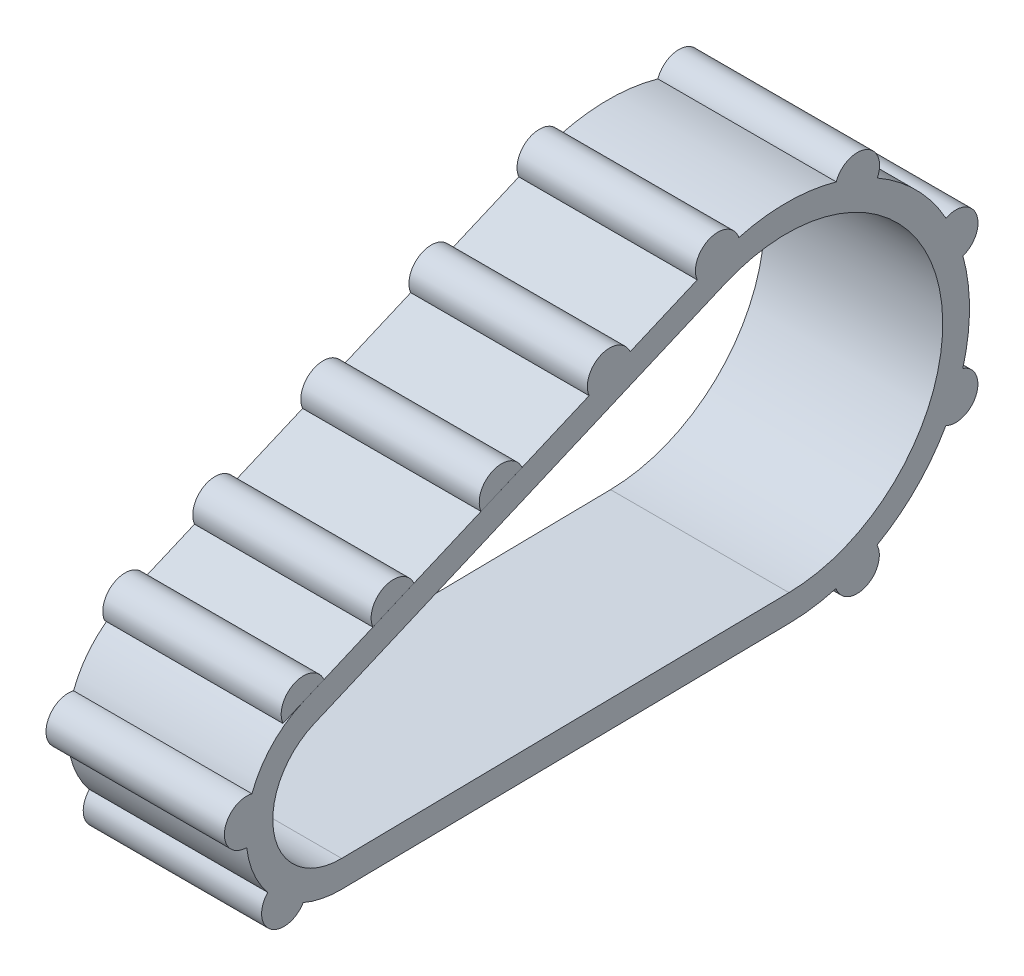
SolidWorks part; units mm, degrees
ref_plane "Front Plane" through (0, 0, 0) normal (0, 0, 1) x (1, 0, 0)
ref_plane "Top Plane" through (0, 0, 0) normal (0, 1, 0) x (1, 0, 0)
ref_plane "Right Plane" through (0, 0, 0) normal (1, 0, 0) x (0, 0, -1)
mirrored part "tread with tread 5 belt2.dennis_Mirrored"
other "<tread with tread 5 belt2.dennis>-<Boss-Extrude4[1]>"
other "<tread with tread 5 belt2.dennis>-<Boss-Extrude4[2]>"
other "<tread with tread 5 belt2.dennis>-<Boss-Extrude4[3]>"
other "<tread with tread 5 belt2.dennis>-<Boss-Extrude4[4]>"
